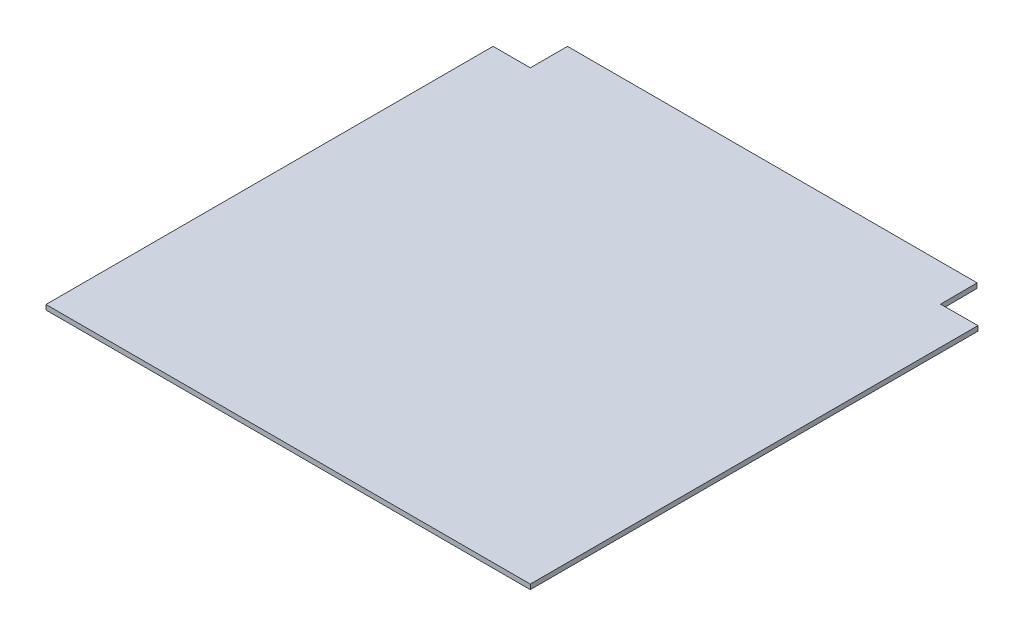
SolidWorks part; units mm, degrees
ref_plane "Front Plane" through (0, 0, 0) normal (0, 0, 1) x (1, 0, 0)
ref_plane "Top Plane" through (0, 0, 0) normal (0, 1, 0) x (1, 0, 0)
ref_plane "Right Plane" through (0, 0, 0) normal (1, 0, 0) x (0, 0, -1)
sketch "Sketch1" plane through (0, 0, 0) normal (0, 1, 0) x (1, 0, 0)
  line L0 (-524.3738, 370.7453) -> (-446.7628, 370.7453)
  line L5 (-446.7628, 447.3859) -> (397.5564, 447.3859)
  line L6 (-523.4951, 370.7453) -> (-523.4951, -550.8568)
  line L7 (-523.4951, -550.8568) -> (474.7475, -550.8568)
  line L8 (474.7475, 372.0134) -> (474.7475, -550.8568)
  line L9 (-446.7628, 370.7453) -> (-446.7628, 447.3859)
  line L10 (474.7475, 372.0134) -> (397.9303, 371.6342)
  line L11 (397.9303, 371.6342) -> (397.5564, 447.3859)
extrude "Boss-Extrude1" add sketch "Sketch1" along normal blind 10 contours L10 L11 L5 L9 L0 L6 L7 L8
